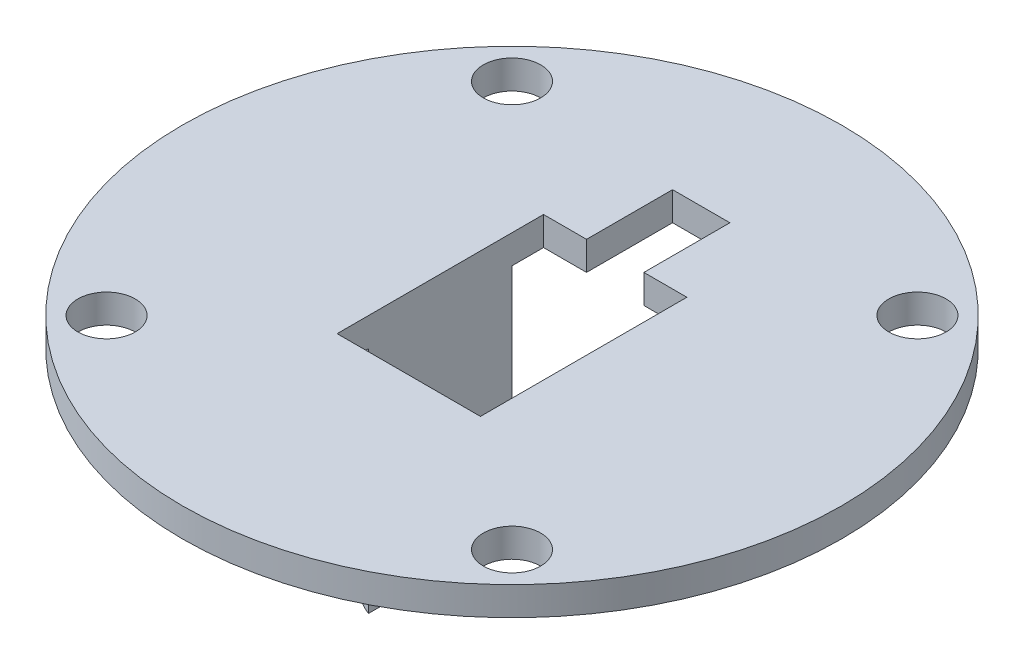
SolidWorks part; units mm, degrees
ref_plane "Front Plane" through (0, 0, 0) normal (0, 0, 1) x (1, 0, 0)
ref_plane "Top Plane" through (0, 0, 0) normal (0, 1, 0) x (1, 0, 0)
ref_plane "Right Plane" through (0, 0, 0) normal (1, 0, 0) x (0, 0, -1)
sketch "Sketch2" plane through (0, 0, 0) normal (0, 1, 0) x (1, 0, 0)
  circle A0 centre (0, 0) radius 57.5
  dimension "D1" = 115
extrude "Boss-Extrude1" add sketch "Sketch2" along normal blind 5
sketch "Sketch3" plane through (0, 5, 0) normal (0, 1, 0) x (1, 0, 0)
  line L0 (-35.3553, -35.3553) -> (35.3553, -35.3553) construction
  line L1 (35.3553, -35.3553) -> (35.3553, 35.3553) construction
  line L2 (35.3553, 35.3553) -> (-35.3553, 35.3553) construction
  line L3 (-35.3553, 35.3553) -> (-35.3553, -35.3553) construction
  circle A0 centre (-35.3553, 35.3553) radius 5
  circle A1 centre (35.3553, 35.3553) radius 5
  circle A2 centre (35.3553, -35.3553) radius 5
  circle A3 centre (-35.3553, -35.3553) radius 5
  point P8 (0, 50)
  point P10 (0, 50)
  point P11 (0, 0)
  point P12 (-35.4688, 35.2415)
  dimension "D1" = 10
  dimension "D2" = 10
  dimension "D3" = 10
  dimension "D4" = 10
  dimension "D6" = 50
  dimension "D7" = 50
  dimension "D8" = 50
extrude "Cut-Extrude1" cut sketch "Sketch3" against normal through all
sketch "Sketch4" plane through (0, 5, 0) normal (0, 1, 0) x (1, 0, 0)
  line L1 (-12.5, -18) -> (12.5, -18)
  line L2 (-12.5, -18) -> (-12.5, 18)
  line L3 (-12.5, 18) -> (12.5, 18)
  line L4 (12.5, -18) -> (12.5, 18)
  line L5 (-12.5, -18) -> (12.5, 18) construction
  line L6 (-12.5, 18) -> (12.5, -18) construction
  point P0 (0, 0)
  dimension "D1" = 25
  dimension "D2" = 36
extrude "Cut-Extrude2" cut sketch "Sketch4" against normal through all
sketch "Sketch5" plane through (0, 0, 0) normal (0, -1, 0) x (1, 0, 0)
  line L0 (-12.5, 18) -> (12.5, 18) construction
  line L1 (-17.5, -12.5) -> (-12.5, -12.5)
  line L2 (-17.5, -12.5) -> (-17.5, 12.5)
  line L3 (-17.5, 12.5) -> (-12.5, 12.5)
  line L4 (-12.5, -12.5) -> (-12.5, 12.5)
  line L5 (-17.5, -12.5) -> (-12.5, 12.5) construction
  line L6 (-17.5, 12.5) -> (-12.5, -12.5) construction
  line L7 (-12.5, -18) -> (-12.5, 18) construction
  point P0 (-15, 0)
  dimension "D1" = 5
  dimension "D2" = 25
  dimension "D3" = 5.5
extrude "Boss-Extrude2" add sketch "Sketch5" along normal blind 40
fillet "Fillet1" radius 6 3 edges at (-17.5, -40, 0) (-17.5, -20, -12.5) (-17.5, -20, 12.5)
sketch "Sketch7" plane through (0, 5, 0) normal (0, 1, 0) x (1, 0, 0)
  line L0 (12.5, -18) -> (12.5, 18) construction
  line L1 (-5, 18) -> (5, 18)
  line L2 (-5, 18) -> (-5, 33)
  line L3 (-5, 33) -> (5, 33)
  line L4 (5, 18) -> (5, 33)
  line L5 (-5, 18) -> (5, 33) construction
  line L6 (-5, 33) -> (5, 18) construction
  line L7 (12.5, 18) -> (-12.5, 18) construction
  point P0 (0, 25.5)
  dimension "D1" = 15
  dimension "D2" = 10
  dimension "D3" = 7.5
extrude "Cut-Extrude3" cut sketch "Sketch7" against normal through all
